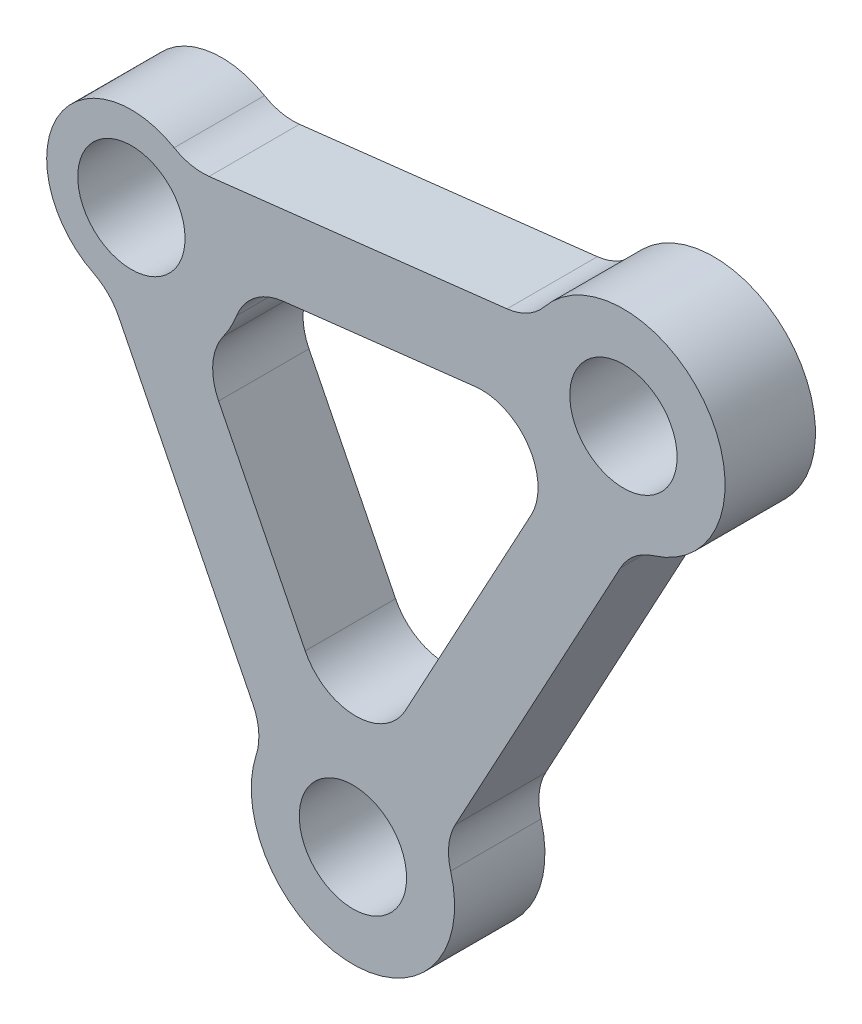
SolidWorks part; units mm, degrees
ref_plane "Face" through (0, 0, 0) normal (0, 0, 1) x (1, 0, 0)
ref_plane "Dessus" through (0, 0, 0) normal (0, 1, 0) x (1, 0, 0)
ref_plane "Droite" through (0, 0, 0) normal (1, 0, 0) x (0, 0, -1)
imported_body "Importée1"
sketch "Esquisse1" plane through (0, 0, -27) normal (0, 0, 1) x (1, 0, 0)
  circle A0 centre (60.6999, 219.3355) radius 4.75
  circle A1 centre (17.14, 214.32) radius 4.75
  circle A2 centre (36.7514, 175.1025) radius 4.75
  circle A3 centre (60.6999, 219.3355) radius 4.05 construction
  circle A4 centre (17.14, 214.32) radius 4 construction
  circle A5 centre (36.7514, 175.1025) radius 4.05 construction
  dimension "D1" = 9.5
extrude "Enlèv. mat.-Extru.1" cut sketch "Esquisse1" against normal through all
